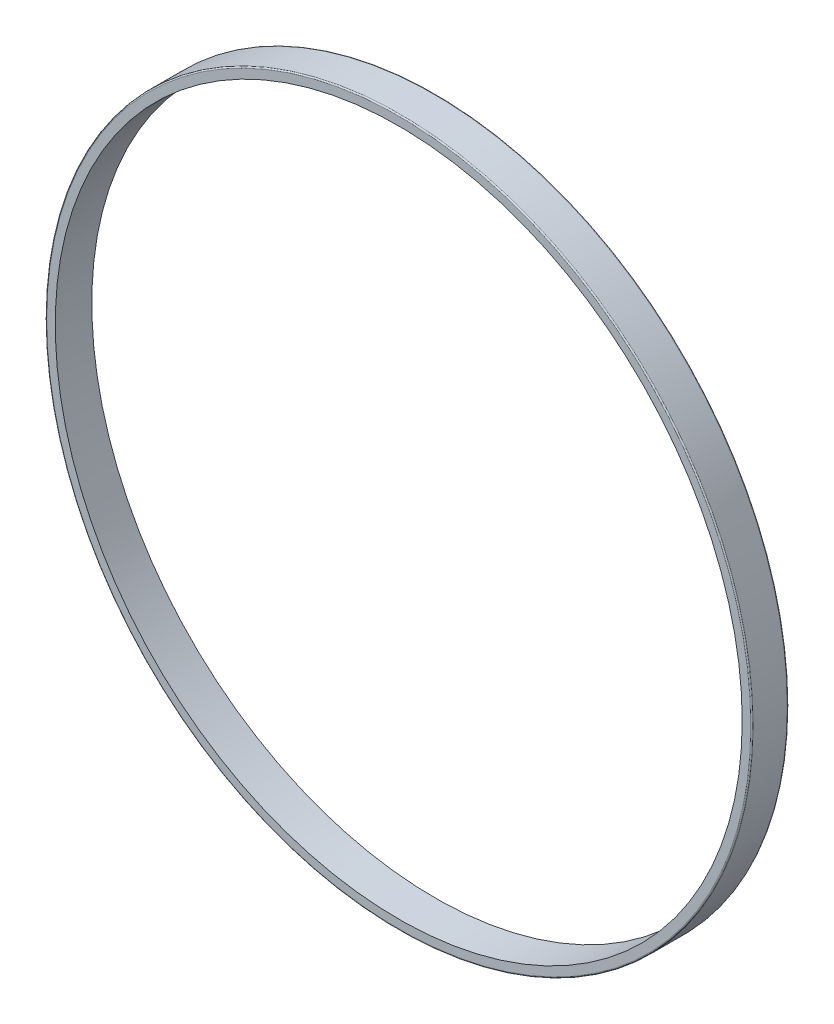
SolidWorks part; units mm, degrees
ref_plane "前视基准面" through (0, 0, 0) normal (0, 0, 1) x (1, 0, 0)
ref_plane "上视基准面" through (0, 0, 0) normal (0, 1, 0) x (1, 0, 0)
ref_plane "右视基准面" through (0, 0, 0) normal (1, 0, 0) x (0, 0, -1)
sketch "草图1" plane through (0, 0, 0) normal (0, 0, 1) x (1, 0, 0)
  circle A0 centre (0, 0) radius 58
  circle A1 centre (0, 0) radius 56.4
  dimension "D1" = 116
  dimension "D2" = 1.6
extrude "凸台-拉伸1" add sketch "草图1" along normal blind 6
fillet "圆角1" radius 0.2 2 edges at (58, 0, 0) (58, 0, 6)
